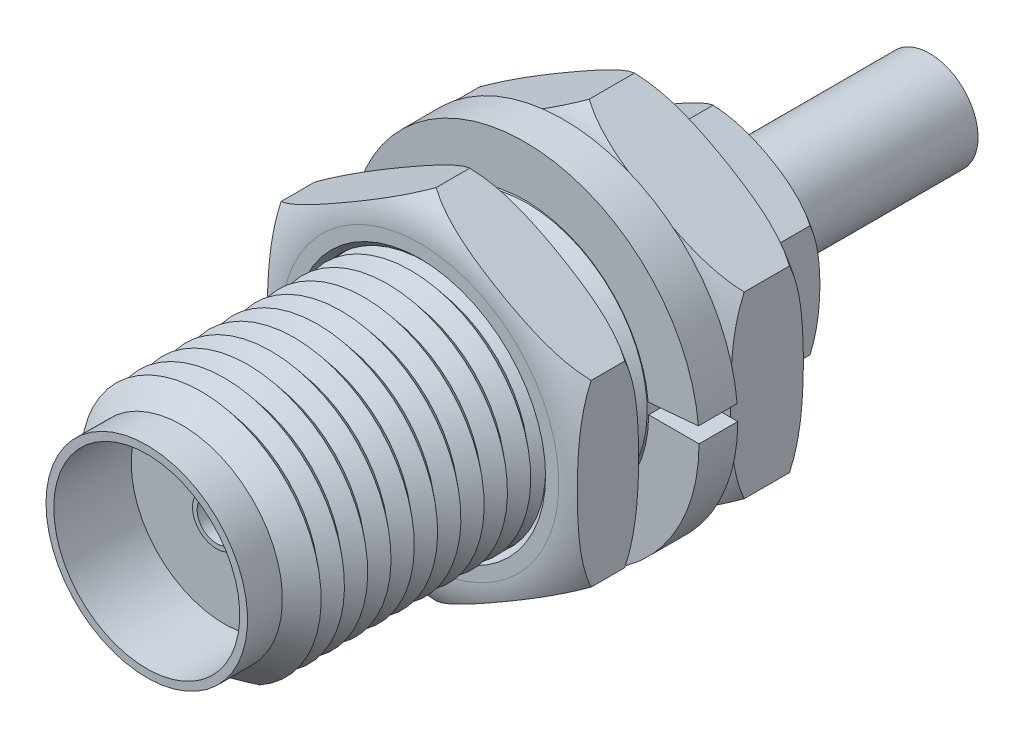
SolidWorks part; units mm, degrees
ref_plane "Front" through (0, 0, 0) normal (0, 0, 1) x (1, 0, 0)
ref_plane "Top" through (0, 0, 0) normal (0, 1, 0) x (1, 0, 0)
ref_plane "Right" through (0, 0, 0) normal (1, 0, 0) x (0, 0, -1)
sketch "Эскиз1" plane through (0, 0, 0) normal (0, 1, 0) x (1, 0, 0)
  line L0 (0, 0) -> (0, -9.75) construction
  line L1 (0, 0) -> (0.5, 0)
  line L2 (0.5, 0) -> (0.5, -7.95)
  line L3 (0.5, -7.95) -> (0.62, -7.95)
  line L4 (0.62, -7.95) -> (0.62, -7.75)
  line L5 (0.62, -7.75) -> (2.4, -7.75)
  line L6 (2.4, -7.75) -> (2.4, -9.75)
  line L7 (2.4, -9.75) -> (2.6, -9.75)
  line L8 (2.6, -9.75) -> (2.6, -8.85)
  line L9 (2.6, -8.85) -> (3.1, -8.35)
  line L10 (3.1, -8.35) -> (3.1, -2.7)
  line L11 (3.1, 1.25) -> (3.582, 1.25)
  line L12 (4.7, 1.75) -> (4.7, 2.75)
  line L13 (3.582, 3.25) -> (3, 3.25)
  line L14 (3, 3.25) -> (3, 4.75)
  line L15 (1.882, 5.25) -> (1.25, 5.25)
  line L16 (1.25, 5.25) -> (1.25, 10.45)
  line L17 (1.25, 10.45) -> (1, 10.45)
  line L18 (0, 5.25) -> (0, 0)
  line L19 (1, 10.45) -> (1, 5.25)
  line L20 (1, 5.25) -> (0, 5.25)
  line L21 (3.1, -1) -> (3.1, 1.25)
  line L22 (3.1, -1) -> (3.582, -1)
  line L24 (3.1, -2.7) -> (3.582, -2.7)
  line L25 (4.7, -1.5) -> (4.7, -2.2)
  arc A0 (3.582, 3.25) -> (4.7, 2.75) centre (3.582, 1.75) cw
  arc A1 (4.7, -1.5) -> (3.582, -1) centre (3.582, -2.5) ccw
  arc A2 (4.7, -2.2) -> (3.582, -2.7) centre (3.582, -1.2) cw
  arc A3 (4.7, 1.75) -> (3.582, 1.25) centre (3.582, 2.75) cw
  arc A4 (1.882, 5.25) -> (3, 4.75) centre (1.882, 3.75) cw
  dimension "D22" = 1.5
  dimension "D24" = 1.5
  dimension "D1" = 13
  dimension "D3" = 9.4
  dimension "D4" = 6.2
  dimension "D5" = 5.2
  dimension "D6" = 4.8
  dimension "D7" = 0.9
  dimension "D8" = 45
  dimension "D9" = 2
  dimension "D10" = 1.24
  dimension "D11" = 1
  dimension "D12" = 0.2
  dimension "D13" = 6
  dimension "D14" = 2.5
  dimension "D15" = 2
  dimension "D16" = 7.2
  dimension "D17" = 2
  dimension "D18" = 1.25
  dimension "D19" = 2
  dimension "D20" = 1
  dimension "D21" = 1.7
  dimension "D23" = 0.5
  dimension "D25" = 0.5
revolve "Повернуть1" add sketch "Эскиз1" angle 360 about L0
sketch "Эскиз2" plane through (0, 0, -1.25) normal (0, 0, 1) x (1, 0, 0)
  line L1 (0, 4.6188) -> (-4, 2.3094)
  line L2 (-4, 2.3094) -> (-4, -2.3094)
  line L3 (-4, -2.3094) -> (0, -4.6188)
  line L4 (0, -4.6188) -> (4, -2.3094)
  line L5 (4, -2.3094) -> (4, 2.3094)
  line L6 (4, 2.3094) -> (0, 4.6188)
  circle A0 centre (0, 0) radius 4 construction
  dimension "D1" = 8
extrude "Вытянуть1" cut sketch "Эскиз2" against normal through all and the other way through all flip side to cut
sketch "Эскиз3" plane through (0, 0, -5.25) normal (0, 0, -1) x (-1, 0, 0)
  line L1 (0, 2.8868) -> (-2.5, 1.4434)
  line L2 (-2.5, 1.4434) -> (-2.5, -1.4434)
  line L3 (-2.5, -1.4434) -> (0, -2.8868)
  line L4 (0, -2.8868) -> (2.5, -1.4434)
  line L5 (2.5, -1.4434) -> (2.5, 1.4434)
  line L6 (2.5, 1.4434) -> (0, 2.8868)
  circle A0 centre (0, 0) radius 2.5 construction
  dimension "D1" = 5
extrude "Вытянуть2" cut sketch "Эскиз3" against normal up to surface (2 mm away) flip side to cut
sketch "Эскиз4" plane through (0, 0, 0) normal (0, 1, 0) x (1, 0, 0)
  line L0 (3.1, -8.35) -> (2.742, -8.0496)
  line L1 (2.742, -8.0496) -> (3.1, -7.7491)
  line L3 (3.1, -7.7491) -> (2.742, -7.4487)
  line L4 (3.1, 0.6629) -> (4.6, 0.6629)
  line L5 (4.6, 0.6629) -> (4.6, -1)
  line L6 (4.6, -1) -> (3.2397, -1)
  line L7 (3.582, -1) -> (-3.582, -1) construction
  line L8 (3.2397, -1) -> (3.1, -1.1397)
  line L9 (3.1, -2.3414) -> (3.1, -2.5603)
  line L10 (3.1, -2.5603) -> (3.2397, -2.7)
  line L11 (-3.582, -2.7) -> (3.582, -2.7) construction
  line L12 (3.2397, -2.7) -> (4.6, -2.7)
  line L20 (3.1, -8.35) -> (4.6, -8.35)
  line L21 (4.6, -8.35) -> (4.6, -2.7)
  line L22 (2.742, -7.4487) -> (3.1, -7.1483)
  line L24 (3.1, -7.1483) -> (2.742, -6.8478)
  line L25 (2.742, -6.8478) -> (3.1, -6.5474)
  line L26 (3.1, -6.5474) -> (2.742, -6.247)
  line L27 (2.742, -6.247) -> (3.1, -5.9466)
  line L28 (3.1, -5.9466) -> (2.742, -5.6461)
  line L30 (2.742, -5.6461) -> (3.1, -5.3457)
  line L31 (3.1, -5.3457) -> (2.742, -5.0453)
  line L32 (0, 0) -> (0, -6.85) construction
  line L33 (2.742, -5.0453) -> (3.1, -4.7448)
  line L34 (3.1, -4.7448) -> (2.742, -4.4444)
  line L35 (2.742, -4.4444) -> (3.1, -4.144)
  line L36 (3.1, -4.144) -> (2.742, -3.8435)
  line L37 (2.742, -3.8435) -> (3.1, -3.5431)
  line L38 (3.1, -3.5431) -> (2.742, -3.2427)
  line L39 (2.742, -3.2427) -> (3.1, -2.9423)
  line L40 (3.1, -2.9423) -> (2.742, -2.6418)
  line L41 (2.742, -2.6418) -> (3.1, -2.3414)
  line L42 (3.1, -2.3414) -> (2.742, -2.041)
  line L43 (2.742, -2.041) -> (3.1, -1.7405)
  line L44 (3.1, -1.7405) -> (2.742, -1.4401)
  line L45 (2.742, -1.4401) -> (3.1, -1.1397)
  line L46 (3.1, -1.1397) -> (2.742, -0.8392)
  line L47 (2.742, -0.8392) -> (3.1, -0.5388)
  line L48 (3.1, -0.5388) -> (2.742, -0.2384)
  line L49 (2.742, -0.2384) -> (3.1, 0.062)
  line L50 (3.1, 0.062) -> (2.742, 0.3625)
  line L51 (2.742, 0.3625) -> (3.1, 0.6629)
  dimension "D1" = 45
  dimension "D2" = 1.5
  dimension "D3" = 80
  dimension "D4" = 0.6009
  dimension "D5" = 45
revolve "Вырез-Повернуть1" cut sketch "Эскиз4" angle 360 about L32
sketch "Эскиз5" plane through (0, 0, 0) normal (0, 1, 0) x (1, 0, 0)
  line L0 (3.1, 0.6629) -> (3.1, 1.25) construction
  line L1 (3.1, 1) -> (4.5, 1)
  line L2 (3.1, 1) -> (3.1, 0.6629)
  line L3 (3.2, 0) -> (4.5, 0)
  line L4 (4.5, 1) -> (4.5, 0)
  line L5 (0, 0) -> (0, 3.8253) construction
  line L7 (3.1, 0.6629) -> (3.2, 0.6629)
  line L8 (-3.1, 0.6629) -> (3.1, 0.6629) construction
  line L9 (3.2, 0.6629) -> (3.2, 0)
  dimension "D1" = 9
  dimension "D2" = 1
  dimension "D3" = 0.1
revolve "Повернуть3" add sketch "Эскиз5" angle 355 about L5
sketch "Эскиз6" plane through (0, 0, 0) normal (0, 0, 1) x (1, 0, 0)
  line L0 (-1.5232, -2.7) -> (1.5232, -2.7)
  arc A0 (-1.5232, -2.7) -> (1.5232, -2.7) centre (0, 0) ccw
  dimension "D1" = 6.2
  dimension "D2" = 2.7
extrude "Вытянуть3" cut sketch "Эскиз6" against normal up to surface and the other way through all
